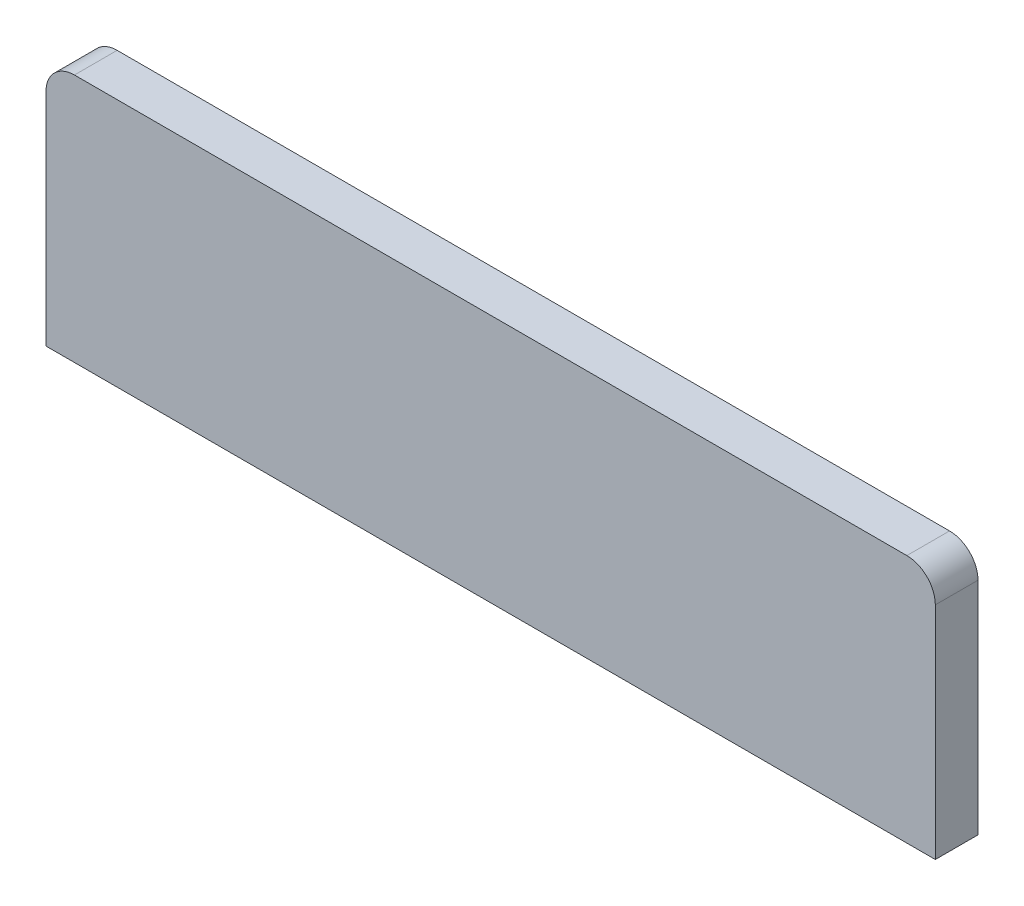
SolidWorks part; units mm, degrees
ref_plane "Front Plane" through (0, 0, 0) normal (0, 0, 1) x (1, 0, 0)
ref_plane "Top Plane" through (0, 0, 0) normal (0, 1, 0) x (1, 0, 0)
ref_plane "Right Plane" through (0, 0, 0) normal (1, 0, 0) x (0, 0, -1)
sketch "Sketch1" plane through (0, 0, 0) normal (0, 0, 1) x (1, 0, 0)
  line L1 (0, 0) -> (250, 0)
  line L2 (0, 0) -> (0, 62)
  line L3 (8, 70) -> (242, 70)
  line L4 (250, 0) -> (250, 62)
  arc A0 (242, 70) -> (250, 62) centre (242, 62) cw
  arc A1 (0, 62) -> (8, 70) centre (8, 62) cw
  point P7 (250, 70)
  point P10 (0, 70)
  dimension "D3" = 8
  dimension "D1" = 70
  dimension "D2" = 250
extrude "Boss-Extrude1" add sketch "Sketch1" along normal blind 12
